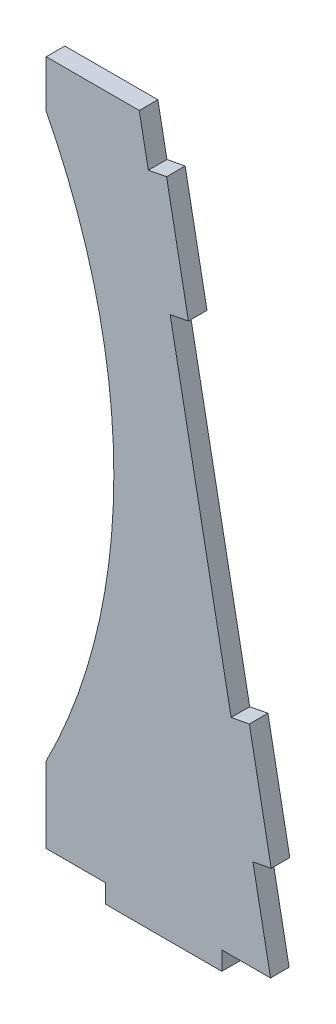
SolidWorks part; units mm, degrees
ref_plane "Front Plane" through (0, 0, 0) normal (0, 0, 1) x (1, 0, 0)
ref_plane "Top Plane" through (0, 0, 0) normal (0, 1, 0) x (1, 0, 0)
ref_plane "Right Plane" through (0, 0, 0) normal (1, 0, 0) x (0, 0, -1)
sketch "Sketch1" plane through (0, 0, 0) normal (0, 0, 1) x (1, 0, 0)
  line L0 (33.4437, 1.143) -> (33.4437, -0.381)
  line L1 (33.4437, -0.381) -> (42.9687, -0.381)
  line L2 (42.9687, -0.381) -> (42.9687, 1.143)
  line L3 (42.9687, 1.143) -> (46.9625, 1.143)
  line L4 (46.9625, 1.143) -> (45.5219, 8.6706)
  line L5 (36.9448, 53.4893) -> (36.2039, 57.361)
  line L6 (43.7316, 18.0258) -> (38.7352, 44.1341)
  line L7 (38.7352, 44.1341) -> (40.232, 44.4205)
  line L8 (45.5219, 8.6706) -> (47.0188, 8.957)
  line L9 (36.9448, 53.4893) -> (38.4417, 53.7758)
  line L10 (43.7316, 18.0258) -> (45.2284, 18.3123)
  line L11 (36.2039, 57.361) -> (28.5737, 57.361)
  line L12 (40.232, 44.4205) -> (38.4417, 53.7758)
  line L13 (28.5737, 57.361) -> (28.5737, 53.4893)
  line L14 (47.0188, 8.957) -> (45.2284, 18.3123)
  line L15 (28.5737, 1.143) -> (33.4437, 1.143)
  line L16 (28.5737, 7.3637) -> (28.5737, 1.143)
  arc A0 (28.5737, 7.3637) -> (28.5737, 53.4893) centre (-16.6139, 30.4265) ccw
extrude "Boss-Extrude1" add sketch "Sketch1" along normal blind 1.524
